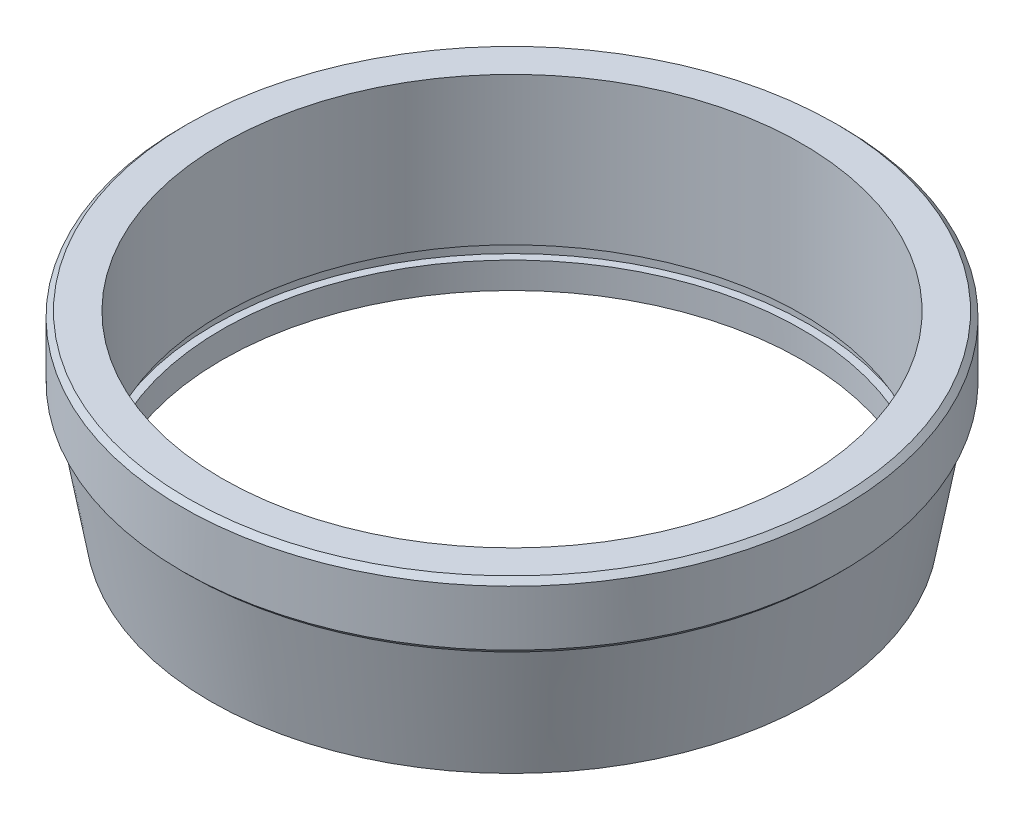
SolidWorks part; units mm, degrees
ref_plane "Přední rovina" through (0, 0, 0) normal (0, 0, 1) x (1, 0, 0)
ref_plane "Horní rovina" through (0, 0, 0) normal (0, 1, 0) x (1, 0, 0)
ref_plane "Pravá rovina" through (0, 0, 0) normal (1, 0, 0) x (0, 0, -1)
sketch "Skica1" plane through (0, 0, 0) normal (0, 1, 0) x (1, 0, 0)
  circle A0 centre (0, 0) radius 12.25
extrude "Přidat vysunutím1" add sketch "Skica1" against normal blind 4.6 draft 10
sketch "Skica2" plane through (0, 0, 0) normal (0, 1, 0) x (-1, 0, 0)
  circle A0 centre (0, 0) radius 12.5
extrude "Přidat vysunutím2" add sketch "Skica2" along normal blind 2.5
chamfer "Zkosení1" distance 0.2 angle 45 2 edges at (0, 0, 12.5) (0, 2.5, 12.5)
sketch "Skica3" plane through (0, 2.5, 0) normal (0, 1, 0) x (1, 0, 0)
  circle A0 centre (0, 0) radius 11
extrude "Odebrat vysunutím1" cut sketch "Skica3" against normal blind 2.5
sketch "Skica4" plane through (0, -4.6, 0) normal (0, -1, 0) x (1, 0, 0)
  circle A0 centre (0, 0) radius 11
extrude "Odebrat vysunutím2" cut sketch "Skica4" against normal up to surface (4.6 mm away)
sketch "Skica5" plane through (0, 0, 0) normal (0, 0, 1) x (1, 0, 0)
  line L0 (-11.4389, -4.6) -> (11.4389, -4.6) construction
  line L1 (-11.3, -3.6) -> (-11, -3.6)
  line L2 (-11.3, -3.6) -> (-11.3, -3.1)
  line L3 (-11.3, -3.1) -> (-11, -3.1)
  line L4 (-11, -3.6) -> (-11, -3.1)
  line L5 (-11, -4.6) -> (11, -4.6) construction
  point P8 (-3.25, -4.6)
  dimension "D1" = 0.3
  dimension "D2" = 0.5
  dimension "D3" = 1
  dimension "D5" = 11.3
ref_axis "Osa1" through (0, 2.5, 0) along (0, -1, 0)
revolve "Odebrat rotací1" cut sketch "Skica5" angle 360 about axis through (0, 2.5, 0) along (0, -1, 0)
